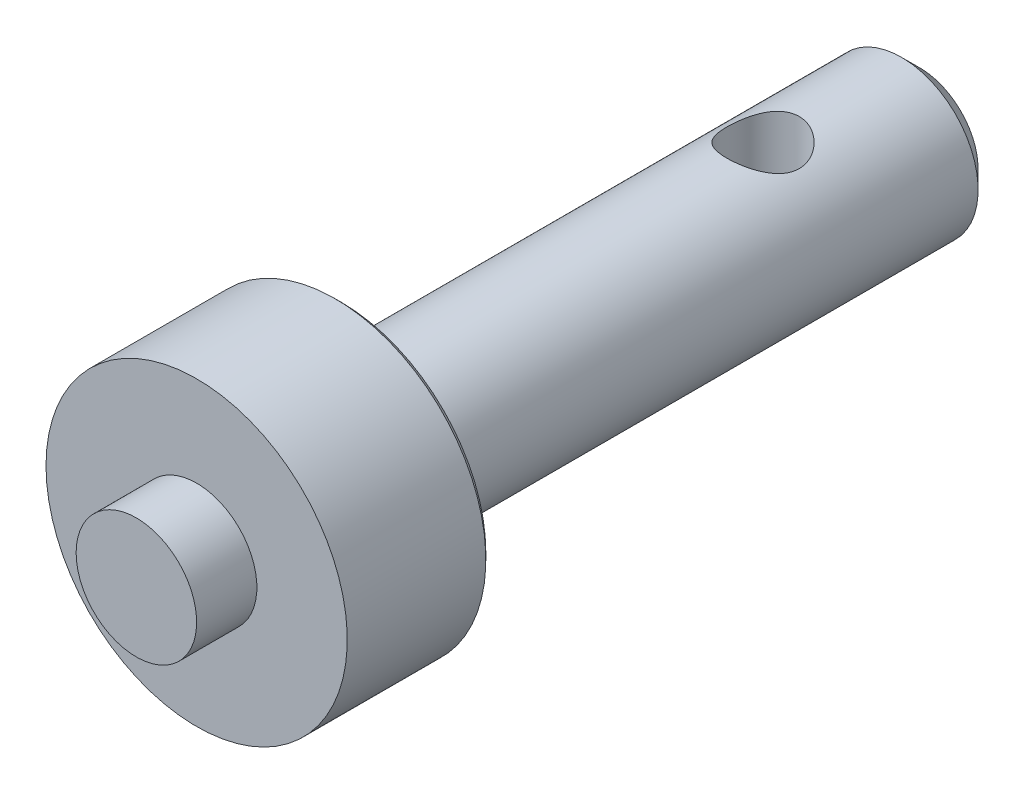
SolidWorks part; units mm, degrees
ref_plane "Спереди" through (0, 0, 0) normal (0, 0, 1) x (1, 0, 0)
ref_plane "Сверху" through (0, 0, 0) normal (0, 1, 0) x (1, 0, 0)
ref_plane "Справа" through (0, 0, 0) normal (1, 0, 0) x (0, 0, -1)
sketch "Эскиз1" plane through (0, 0, 0) normal (1, 0, 0) x (0, 0, -1)
  line L0 (0, 0) -> (0, 5)
  line L1 (0, 5) -> (5, 5)
  line L2 (5, 5) -> (5, 12.5)
  line L3 (5, 12.5) -> (16.5, 12.5)
  line L4 (16.5, 12.5) -> (17, 12)
  line L5 (17, 12) -> (17, 6.35)
  line L6 (17, 6.35) -> (63.5, 6.35)
  line L7 (63.5, 6.35) -> (65, 4.85)
  line L8 (65, 4.85) -> (65, 0)
  line L9 (65, 0) -> (0, 0)
  dimension "D1" = 12
  dimension "D2" = 48
  dimension "D3" = 45
  dimension "D4" = 45
  dimension "D5" = 6.35
  dimension "D6" = 1.5
  dimension "D7" = 5
  dimension "D8" = 12.5
  dimension "D9" = 5
  dimension "D10" = 0.5
revolve "Повернуть1" add sketch "Эскиз1" angle 360 about L9
sketch "Эскиз2" plane through (0, 0, 0) normal (0, 1, 0) x (1, 0, 0)
  line L0 (12, 17) -> (-12, 17) construction
  circle A0 centre (0, 52) radius 3
  dimension "D1" = 6
  dimension "D2" = 35
extrude "Вырез-Вытянуть1" cut sketch "Эскиз2" against normal mid plane 20
